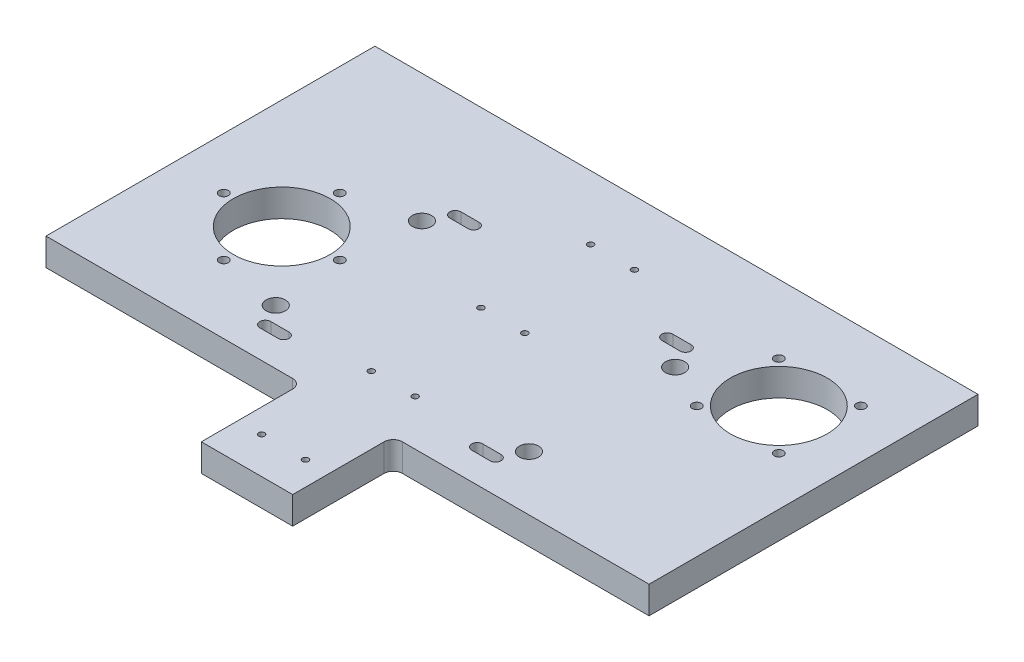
SolidWorks part; units mm, degrees
ref_plane "Plan de face" through (0, 0, 0) normal (0, 0, 1) x (1, 0, 0)
ref_plane "Plan de dessus" through (0, 0, 0) normal (0, 1, 0) x (1, 0, 0)
ref_plane "Plan de droite" through (0, 0, 0) normal (1, 0, 0) x (0, 0, -1)
sketch "Esquisse1" plane through (0, 0, 0) normal (0, 1, 0) x (1, 0, 0)
  line L1 (-165, 75) -> (165, 75)
  line L2 (-165, 75) -> (-165, -75)
  line L3 (-165, -75) -> (165, -75)
  line L4 (165, 75) -> (165, -75)
  line L5 (-165, 75) -> (165, -75) construction
  line L6 (-165, -75) -> (165, 75) construction
  point P0 (0, 0)
  dimension "D1" = 330
  dimension "D2" = 150
extrude "Extrusion1" add sketch "Esquisse1" against normal blind 15
sketch "Esquisse2" plane through (0, 0, 0) normal (0, 1, 0) x (-1, 0, 0)
  line L0 (-165, 75) -> (-165, -75) construction
  line L1 (-165, -75) -> (165, -75) construction
  line L2 (-116, -45) -> (-68.7197, -45) construction
  line L3 (-116, -45) -> (-71.0987, -0.0987) construction
  circle A0 centre (-116, -45) radius 26.5
  circle A1 centre (105, 6) radius 26.5
  circle A2 centre (105, -25.75) radius 2.5
  circle A3 centre (-138.4506, -22.5494) radius 2.5
  circle A4 centre (-93.5494, -22.5494) radius 2.5
  circle A5 centre (-93.5494, -67.4506) radius 2.5
  circle A6 centre (-138.4506, -67.4506) radius 2.5
  circle A7 centre (73.235, 5.985) radius 2.5
  circle A8 centre (104.9699, 37.75) radius 2.5
  circle A9 centre (136.735, 6.015) radius 2.5
  circle A10 centre (-116, -45) radius 31.75 construction
  circle A11 centre (105, 6) radius 31.75 construction
  dimension "D1" = 49
  dimension "D3" = 30
  dimension "D5" = 53
  dimension "D6" = 53
  dimension "D12" = 63.5
  dimension "D9" = 5
  dimension "D8" = 5
  dimension "D2" = 221
  dimension "D4" = 81
  dimension "D13" = 45
extrude "Extrusion2" cut sketch "Esquisse2" against normal through all
sketch "Esquisse4" plane through (0, 0, 75) normal (0, 0, 1) x (1, 0, 0)
  line L0 (-165, -15) -> (165, -15) construction
  line L1 (-25, -15) -> (25, -15)
  line L2 (-25, -15) -> (-25, 0)
  line L3 (-25, 0) -> (25, 0)
  line L4 (25, -15) -> (25, 0)
  line L5 (-165, 0) -> (165, 0) construction
  line L6 (-165, -15) -> (-165, 0) construction
  line L7 (165, -15) -> (165, 0) construction
  dimension "D1" = 140
  dimension "D2" = 140
extrude "support mors fixe " add sketch "Esquisse4" along normal blind 55
sketch "Esquisse6" plane through (0, 0, -75) normal (0, 0, -1) x (-1, 0, 0)
  line L1 (165, -15) -> (-165, -15)
  line L2 (165, -15) -> (165, 0)
  line L3 (165, 0) -> (-165, 0)
  line L4 (-165, -15) -> (-165, 0)
extrude "Extrusion6" add sketch "Esquisse6" along normal blind 30
sketch "Esquisse12" plane through (0, 0, 0) normal (0, 1, 0) x (-1, 0, 0)
  line L0 (-140.9506, -67.4506) -> (123.8589, -67.4506) construction
  circle A0 centre (-138.4506, -67.4506) radius 2.5 construction
sketch "Esquisse13" plane through (0, 0, 0) normal (0, 1, 0) x (-1, 0, 0)
  line L0 (165, -105) -> (-165, -105) construction
  line L1 (165, -105) -> (165, 75) construction
  line L2 (165, 75) -> (25, 75) construction
  line L3 (-165, 75) -> (-165, -105) construction
  line L4 (-25, 75) -> (-165, 75) construction
  circle A0 centre (69.28, -35) radius 5.25
  circle A1 centre (69.28, 45) radius 5.25
  circle A2 centre (-69.28, -35) radius 5.25
  circle A3 centre (-69.28, 45) radius 5.25
  dimension "D1" = 70
  dimension "D2" = 10.5
  dimension "D4" = 10.5
  dimension "D6" = 95.72
  dimension "D8" = 10.5
  dimension "D11" = 10.5
  dimension "D3" = 95.72
  dimension "D5" = 30
  dimension "D7" = 70
  dimension "D9" = 95.72
  dimension "D10" = 95.72
  dimension "D12" = 30
extrude "Extrusion9" cut sketch "Esquisse13" against normal up to next
sketch "Esquisse14" plane through (0, 0, 0) normal (0, 1, 0) x (-1, 0, 0)
  line L2 (-158.3053, -55.9832) -> (163.5987, -55.9832) construction
  line L3 (63, 57) -> (53, 57) construction
  line L4 (63, 54) -> (53, 54)
  line L5 (63, 60) -> (53, 60)
  line L6 (165, 75) -> (25, 75) construction
  line L7 (165, -105) -> (165, 75) construction
  line L8 (-53, 57) -> (-63, 57) construction
  line L9 (-53, 54) -> (-63, 54)
  line L10 (-53, 60) -> (-63, 60)
  line L12 (63, -47) -> (53, -47) construction
  line L13 (63, -50) -> (53, -50)
  line L14 (63, -44) -> (53, -44)
  line L15 (-53, -47) -> (-63, -47) construction
  line L16 (-53, -50) -> (-63, -50)
  line L17 (-53, -44) -> (-63, -44)
  line L18 (-25, 75) -> (-165, 75) construction
  line L19 (-165, 75) -> (-165, -105) construction
  line L20 (165, -105) -> (-165, -105) construction
  arc A0 (63, 54) -> (63, 60) centre (63, 57) ccw
  arc A1 (53, 60) -> (53, 54) centre (53, 57) ccw
  arc A2 (-53, 54) -> (-53, 60) centre (-53, 57) ccw
  arc A3 (-63, 60) -> (-63, 54) centre (-63, 57) ccw
  arc A4 (63, -50) -> (63, -44) centre (63, -47) ccw
  arc A5 (53, -44) -> (53, -50) centre (53, -47) ccw
  arc A6 (-53, -50) -> (-53, -44) centre (-53, -47) ccw
  arc A7 (-63, -44) -> (-63, -50) centre (-63, -47) ccw
  point P2 (58, 57)
  point P18 (-58, 57)
  point P25 (58, -47)
  point P32 (-58, -47)
  dimension "D3" = 10
  dimension "D6" = 102
  dimension "D8" = 102
  dimension "D1" = 15
  dimension "D2" = 6
  dimension "D4" = 102
  dimension "D5" = 15
  dimension "D7" = 55
extrude "Extrusion10" cut sketch "Esquisse14" against normal up to next
sketch "Esquisse15" plane through (0, -15, 0) normal (0, -1, 0) x (1, 0, 0)
  line L0 (-25, 130) -> (25, 130) construction
  line L1 (12, 110) -> (12, -70) construction
  line L2 (-25, 130) -> (-25, 75) construction
  line L3 (-12, 110) -> (-12, -70) construction
  line L4 (12, -70) -> (-12, -70) construction
  line L5 (12, -10) -> (-12, -10) construction
  line L6 (12, 50) -> (-12, 50) construction
  line L7 (12, 110) -> (-12, 110) construction
  line L8 (0, 130.8137) -> (0, 62.4261) construction
  line L10 (25, 130) -> (25, 75) construction
  circle A0 centre (12, 110) radius 1.65
  circle A1 centre (-12, 110) radius 1.65
  circle A2 centre (-12, 50) radius 1.65
  circle A3 centre (12, 50) radius 1.65
  circle A4 centre (-12, -10) radius 1.65
  circle A5 centre (12, -10) radius 1.65
  circle A6 centre (-12, -70) radius 1.65
  circle A7 centre (12, -70) radius 1.65
  dimension "D1" = 60
  dimension "D2" = 3.3
  dimension "D3" = 20
  dimension "D4" = 60
  dimension "D5" = 60
  dimension "D7" = 24
extrude "fixation glissière" cut sketch "Esquisse15" against normal up to next
fillet "Congé1" [suppressed] radius 5
fillet "Congé2" radius 5 2 edges
